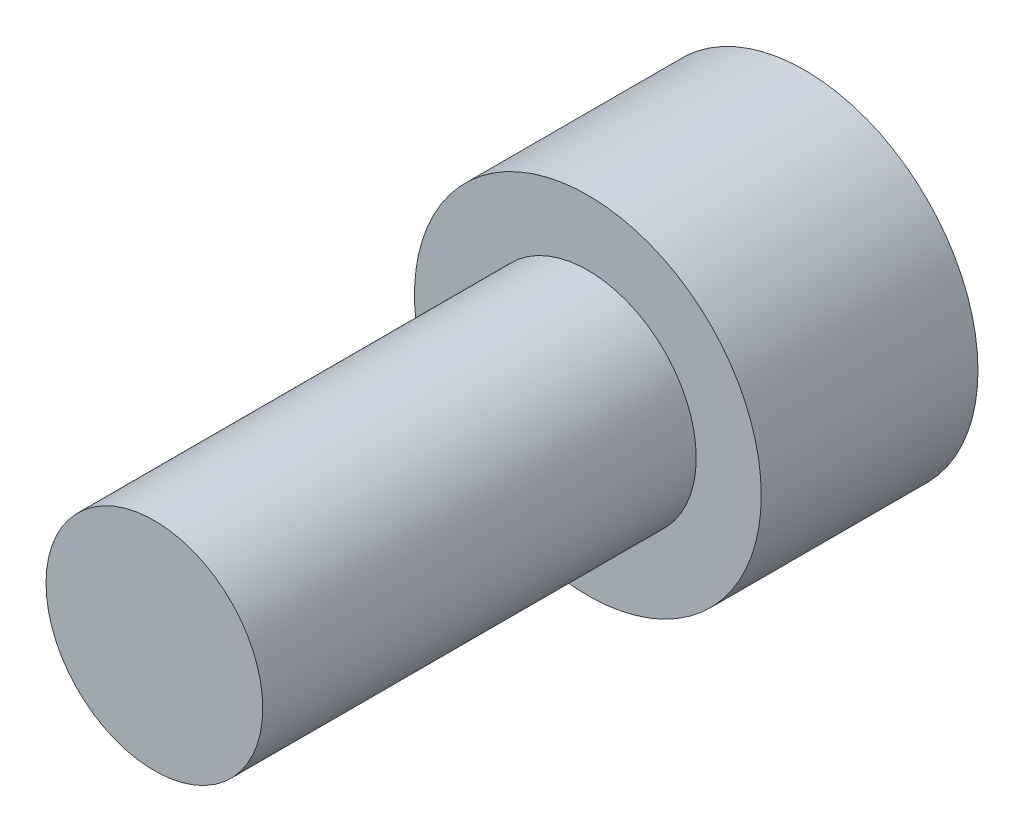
SolidWorks part; units mm, degrees
ref_plane "Front Plane" through (0, 0, 0) normal (0, 0, 1) x (1, 0, 0)
ref_plane "Top Plane" through (0, 0, 0) normal (0, 1, 0) x (1, 0, 0)
ref_plane "Right Plane" through (0, 0, 0) normal (1, 0, 0) x (0, 0, -1)
sketch "Sketch6" plane through (0, 0, 0) normal (1, 0, 0) x (0, 0, -1)
  line L0 (-20, 0) -> (22.525, 0) construction
  line L1 (8.8, 0) -> (-8.8, 0) construction
  line L2 (-20, 0) -> (-20, -5)
  line L3 (-20, -5) -> (0, -5)
  line L4 (0, 8.8) -> (0, -8.8) construction
  line L5 (0, -5) -> (0, -8)
  line L6 (0, -8) -> (10, -8)
  line L7 (10, -8) -> (10, 0)
  line L8 (10, 0) -> (-20, 0)
  dimension "L" = 20
  dimension "H" = 10
  dimension "A" = 16
  dimension "D" = 10
revolve "Revolve1" add sketch "Sketch6" angle 360 about L0
sketch "Sketch7" plane through (0, 0, -10) normal (0, 0, -1) x (-1, 0, 0)
  line L2 (-4, 2.3094) -> (-4, -2.3094)
  line L4 (-4, -2.3094) -> (0, -4.6188)
  line L5 (0, -4.6188) -> (4, -2.3094)
  line L6 (4, -2.3094) -> (4, 2.3094)
  line L7 (4, 2.3094) -> (0, 4.6188)
  line L8 (0, 4.6188) -> (-4, 2.3094)
  circle A0 centre (0, 0) radius 4 construction
  dimension "J" = 8
extrude "HEX" cut sketch "Sketch7" against normal blind 8
